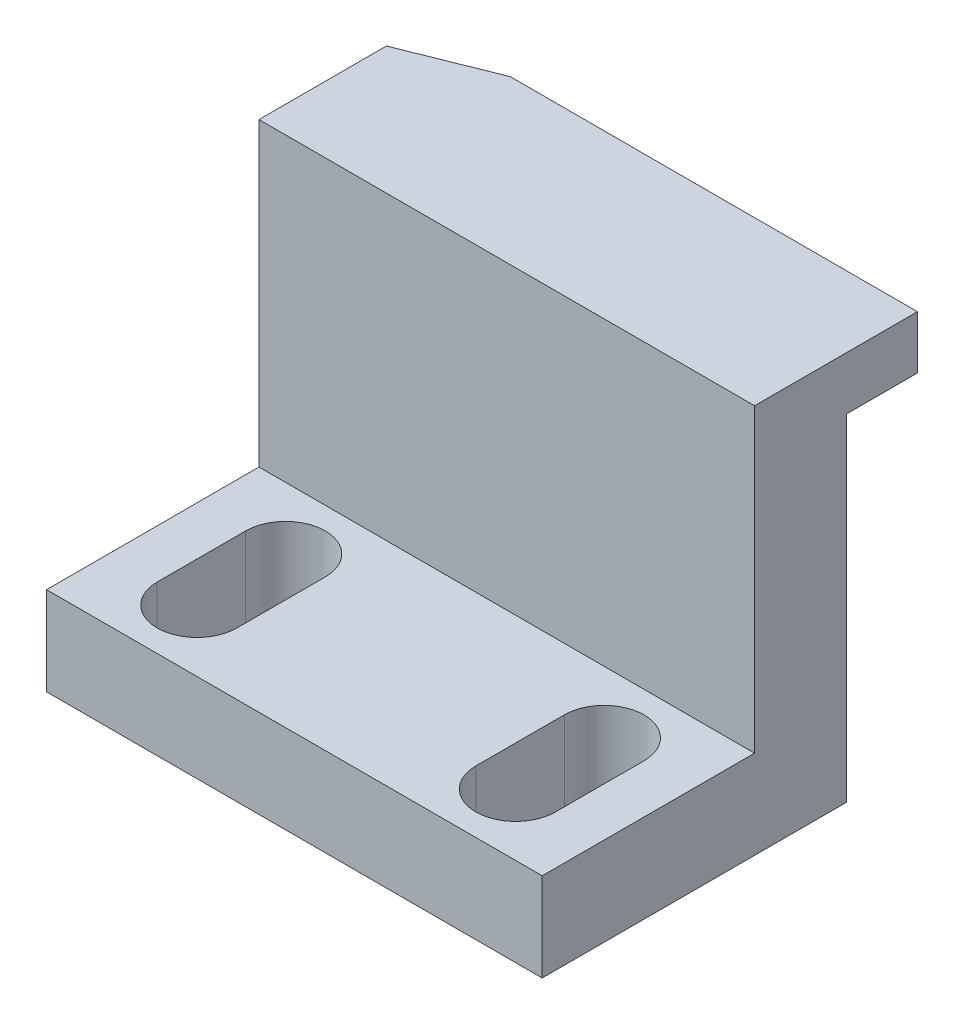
SolidWorks part; units mm, degrees
ref_plane "前视基准面" through (0, 0, 0) normal (0, 0, 1) x (1, 0, 0)
ref_plane "上视基准面" through (0, 0, 0) normal (0, 1, 0) x (1, 0, 0)
ref_plane "右视基准面" through (0, 0, 0) normal (1, 0, 0) x (0, 0, -1)
sketch "草图1" plane through (0, 0, 0) normal (0, 0, 1) x (1, 0, 0)
  line L0 (0, 0) -> (0, 22)
  line L1 (28, 0) -> (28, 22)
  line L2 (0, 0) -> (28, 0)
  line L3 (0, 22) -> (28, 22)
extrude "凸台-拉伸1" add sketch "草图1" along normal blind 21.2
sketch "草图2" plane through (28, 0, 0) normal (1, 0, 0) x (0, 0, -1)
  line L0 (-21.2, 0) -> (-21.2, 5)
  line L1 (-9.2, 5) -> (-9.2, 22)
  line L2 (0, 19) -> (0, 22)
  line L3 (-21.2, 0) -> (-4, 0)
  line L4 (-21.2, 5) -> (-9.2, 5)
  line L5 (-9.2, 22) -> (0, 22)
  line L6 (-4, 0) -> (-4, 19)
  line L7 (-4, 19) -> (0, 19)
extrude "切除-拉伸1" cut sketch "草图2" against normal through all flip side to cut
sketch "草图3" plane through (0, 22, 0) normal (0, 1, 0) x (1, 0, 0)
  line L0 (0, -21.2) -> (28, -21.2)
  line L1 (5, 0) -> (28, 0)
  line L2 (0, -21.2) -> (0, -2)
  line L3 (28, -21.2) -> (28, 0)
  line L4 (0, -2) -> (5, 0)
  line L5 (25.25, -17.7) -> (25.25, -12.7)
  line L6 (20.75, -12.7) -> (20.75, -17.7)
  line L7 (7.25, -17.7) -> (7.25, -12.7)
  line L8 (2.75, -12.7) -> (2.75, -17.7)
  arc A0 (25.25, -12.7) -> (20.75, -12.7) centre (23, -12.7) ccw
  arc A1 (20.75, -17.7) -> (25.25, -17.7) centre (23, -17.7) ccw
  arc A2 (7.25, -12.7) -> (2.75, -12.7) centre (5, -12.7) ccw
  arc A3 (2.75, -17.7) -> (7.25, -17.7) centre (5, -17.7) ccw
extrude "切除-拉伸2" cut sketch "草图3" against normal through all flip side to cut
